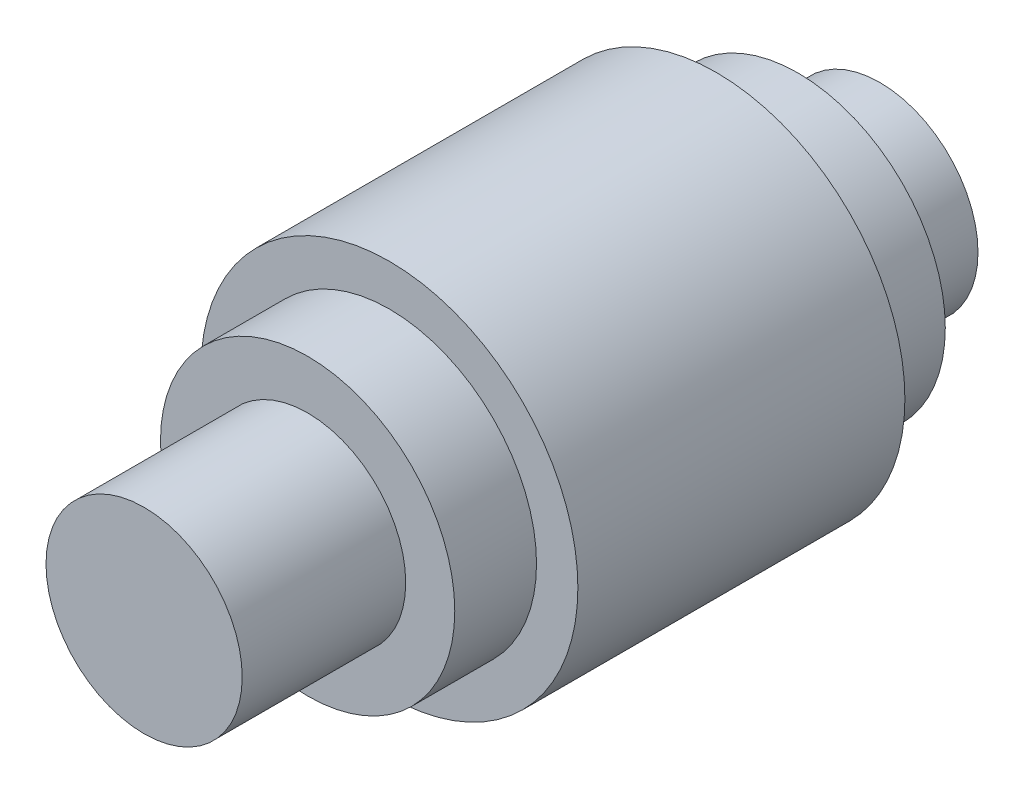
SolidWorks part; units mm, degrees
ref_plane "Front Plane" through (0, 0, 0) normal (0, 0, 1) x (1, 0, 0)
ref_plane "Top Plane" through (0, 0, 0) normal (0, 1, 0) x (1, 0, 0)
ref_plane "Right Plane" through (0, 0, 0) normal (1, 0, 0) x (0, 0, -1)
sketch "Sketch2" plane through (0, 0, 0) normal (0, 0, 1) x (1, 0, 0)
  circle A0 centre (0, 0) radius 11.5293
extrude "Boss-Extrude1" add sketch "Sketch2" along normal blind 20
sketch "Sketch3" plane through (0, 0, 20) normal (0, 0, 1) x (1, 0, 0)
  circle A0 centre (0, 0) radius 9
extrude "Boss-Extrude2" add sketch "Sketch3" along normal blind 5
sketch "Sketch4" plane through (0, 0, 25) normal (0, 0, 1) x (1, 0, 0)
  circle A0 centre (0, 0) radius 6
extrude "Boss-Extrude3" add sketch "Sketch4" along normal blind 10
sketch "Sketch10" plane through (0, 0, 0) normal (0, 0, -1) x (-1, 0, 0)
  circle A0 centre (0, 0) radius 9
extrude "Boss-Extrude7" add sketch "Sketch10" along normal blind 5
sketch "Sketch11" plane through (0, 0, -5) normal (0, 0, -1) x (-1, 0, 0)
  circle A0 centre (0, 0) radius 6
extrude "Boss-Extrude8" add sketch "Sketch11" along normal blind 5
